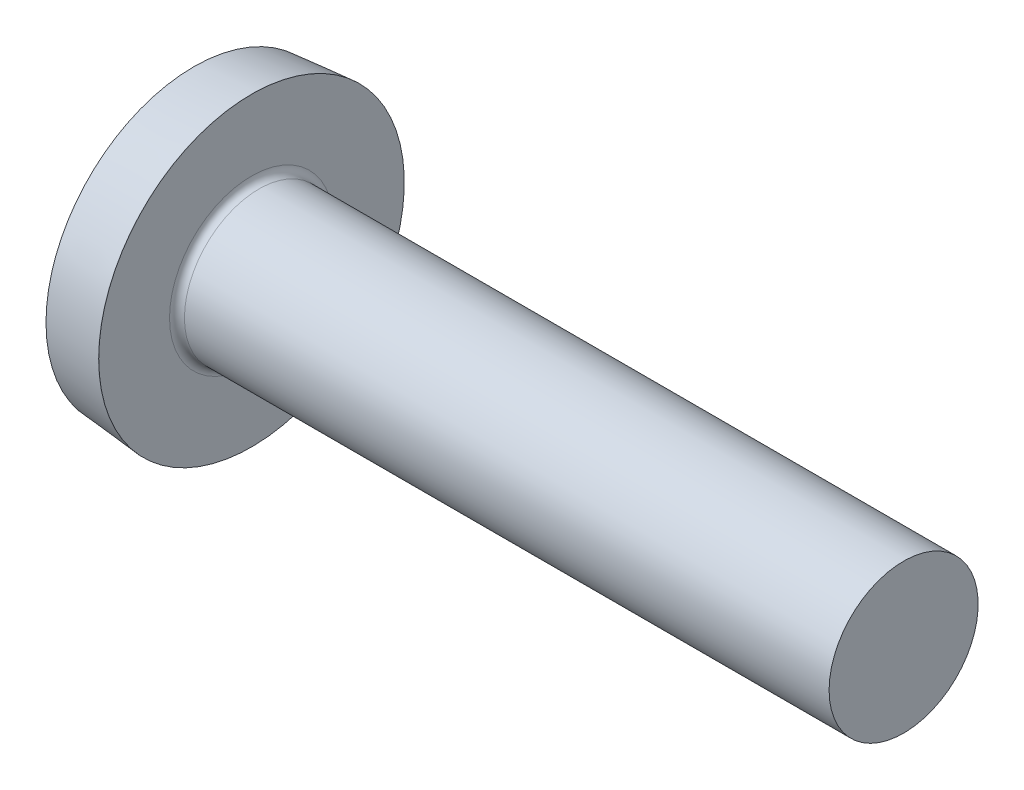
SolidWorks part; units mm, degrees
ref_plane "Plane1" through (0, 0, 0) normal (0, 0, 1) x (1, 0, 0)
ref_plane "Plane2" through (0, 0, 0) normal (0, 1, 0) x (1, 0, 0)
ref_plane "Plane3" through (0, 0, 0) normal (1, 0, 0) x (0, 0, -1)
sketch "BodySke" plane through (0, 0, 0) normal (0, 0, 1) x (1, 0, 0)
  line L0 (4.8, 4) -> (4.8, 8.2)
  line L1 (6.05, 6.35) -> (6.05, -3.175) construction
  line L2 (-25.4, 0) -> (127, 0) construction
  line L3 (39.8, 0) -> (0, 0)
  line L4 (4.8, 4) -> (39.8, 4)
  line L5 (39.8, 4) -> (39.8, 0)
  line L6 (1.7, 7.9297) -> (4.79, 8.2)
  line L8 (9.8, 6.35) -> (9.8, -3.175) construction
  line L9 (4.8, 8.2) -> (4.79, 8.2)
  arc A0 (1.7, 7.9297) -> (0, 0) centre (19.344, 0) ccw
  dimension "D1" = 0.01
  dimension "Head_ang" = 85
  dimension "Oval_ht" = 1.7
  dimension "Head_ht" = 4.8
  dimension "Diameter" = 8
  dimension "Length" = 35
  dimension "Head_dia" = 16.4
  dimension "Advance" = 1.25
  dimension "Thread_nom" = 30
revolve "Base-Revolve" add sketch "BodySke"
fillet "Fillet1" radius 0.4 1 edges at (4.8, 0, 4)
sketch "Sketch3" plane through (0, 0, 0) normal (1, 0, 0) x (0, 0, -1)
  line L0 (0.71, -3.9) -> (-0.71, -3.9)
  line L1 (0.71, -3.9) -> (0.71, 3.9)
  line L2 (-0.71, 3.9) -> (0.71, 3.9)
  line L3 (-0.71, 3.9) -> (-0.71, -3.9)
  dimension "D1" = 3.9
  dimension "Cross_dia" = 7.8
  dimension "D2" = 0.71
  dimension "Cross_width" = 1.42
ref_plane "Plane4" through (4.36, 0, 0) normal (1, 0, 0) x (0, 0, -1)
sketch "Sketch4" plane through (4.36, 0, 0) normal (1, 0, 0) x (0, 0, -1)
  line L0 (0.71, -1.7262) -> (-0.71, -1.7262)
  line L1 (0.71, -1.7262) -> (0.71, 1.7262)
  line L2 (-0.71, 1.7262) -> (0.71, 1.7262)
  line L3 (-0.71, 1.7262) -> (-0.71, -1.7262)
  dimension "D1" = 1.42
  dimension "D2" = 3.4524
  dimension "D3" = 0.71
  dimension "D4" = 1.7262
loft "Recess" cut profiles "Sketch3", "Sketch4"
pattern_circular "RecPat" count 2 every 90 about axis through (0, 0, 0) along (1, 0, 0) of "Recess"
sketch "RecCorSke" plane through (0, 0, 0) normal (0, 0, 1) x (1, 0, 0)
  line L0 (-3.175, 0) -> (15.875, 0) construction
  line L1 (-25.4, 0) -> (127, 0) construction
  line L2 (0, 0) -> (0, 1.5854)
  line L3 (0, 1.5854) -> (4.36, 1.2805)
  line L4 (4.36, 1.2805) -> (4.7761, 0)
  line L5 (4.7761, 0) -> (0, 0)
  dimension "Diameter" = 2.561
  dimension "Depth" = 4.36
  dimension "Draft_angle" = 4
  dimension "Bottom_angle" = 18
revolve "RecessCore" cut sketch "RecCorSke" angle 360 about L0
sketch "ThdSchSke" plane through (0, 0, 0) normal (0, 0, 1) x (1, 0, 0)
  line L0 (9.8, -3.3095) -> (9.3165, -4)
  line L1 (9.8, -3.3095) -> (10.2835, -4)
  line L2 (10.2835, -4) -> (10.2835, -5)
  line L3 (-3.175, 0) -> (5.1513, 0) construction
  line L5 (10.2835, -5) -> (9.3165, -5)
  line L6 (9.3165, -5) -> (9.3165, -4)
  dimension "Thread_minor" = 6.619
  dimension "Diameter" = 8
  dimension "Start" = 9.8
  dimension "SideAngle" = 55
  dimension "VeeAngle" = 70
  dimension "Overcut" = 10
revolve "ThreadSchematic" [suppressed] cut sketch "ThdSchSke" angle 360 about L3
pattern_linear "ThdSchPat" [suppressed]
equation "' \"Diameter@BodySke\" = 8"
equation "' \"Length@BodySke\" = 35"
equation "' \"Head_dia@BodySke\" = 16.4"
equation "' \"Oval_ht@BodySke\" = 1.7"
equation "' \"Head_ht@BodySke\" = 4.8"
equation "' \"Thread_nom@BodySke\" =  30"
equation "' \"Head_ang@BodySke\" = 85"
equation "' \"Cross_dia@Sketch3\" = 7.8"
equation "' \"Cross_width@Sketch3\" = 1.42"
equation "' \"Cross_depth@Plane4\" = 4.36"
equation "' \"Diameter@RecCorSke\" = 2.561"
equation "' \"Radius@Fillet1\" = 0.4"
equation "' \"Thread_minor@ThreadCosmetic\" = 6.619"
equation "' \"Advance@BodySke\" = 1.25"
equation "\"D1@Sketch3\" = \"Cross_dia@Sketch3\" / 2"
equation "\"D2@Sketch3\" = \"Cross_width@Sketch3\" / 2"
equation "\"Depth@RecCorSke\" = \"Cross_depth@Plane4\""
equation "\"D1@Sketch4\" = \"Cross_width@Sketch3\""
equation "\"D2@Sketch4\" = \"Cross_dia@Sketch3\" - 2.0 * \"Cross_depth@Plane4\" * tan(26.5  * 0.017453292)"
equation "\"D3@Sketch4\" = \"D1@Sketch4\" / 2"
equation "\"D4@Sketch4\" = \"D2@Sketch4\" / 2"
equation "\"Thread_length@ThreadCosmetic\" = ((sgn( (\"Length@BodySke\" - \"Advance@BodySke\" * 2.0 ) - \"Thread_nom@BodySke\" )-1)*( (\"Length@BodySke\" - \"Advance@BodySke\" * 2.0 ) - \"Thread_nom@BodySke\" ))/-2+ \"Thread_"
equation "\"Thread_minor@ThdSchSke\" = \"Thread_minor@ThreadCosmetic\""
equation "\"Diameter@ThdSchSke\" = \"Diameter@BodySke\""
equation "\"Overcut@ThdSchSke\" = \"Diameter@BodySke\" * 1.25"
equation "\"Start@ThdSchSke\" = \"Head_ht@BodySke\" + \"Length@BodySke\" - \"Thread_length@ThreadCosmetic\"  '---Non-countersunk---"
equation "\"Num_threads@ThdSchPat\" = int( \"Thread_length@ThreadCosmetic\" / \"Advance@BodySke\" + 0.999 )  + 1"
equation "\"Advance@ThdSchPat\" = \"Thread_length@ThreadCosmetic\" /  (\"Num_threads@ThdSchPat\" - 1) 'relax it"
